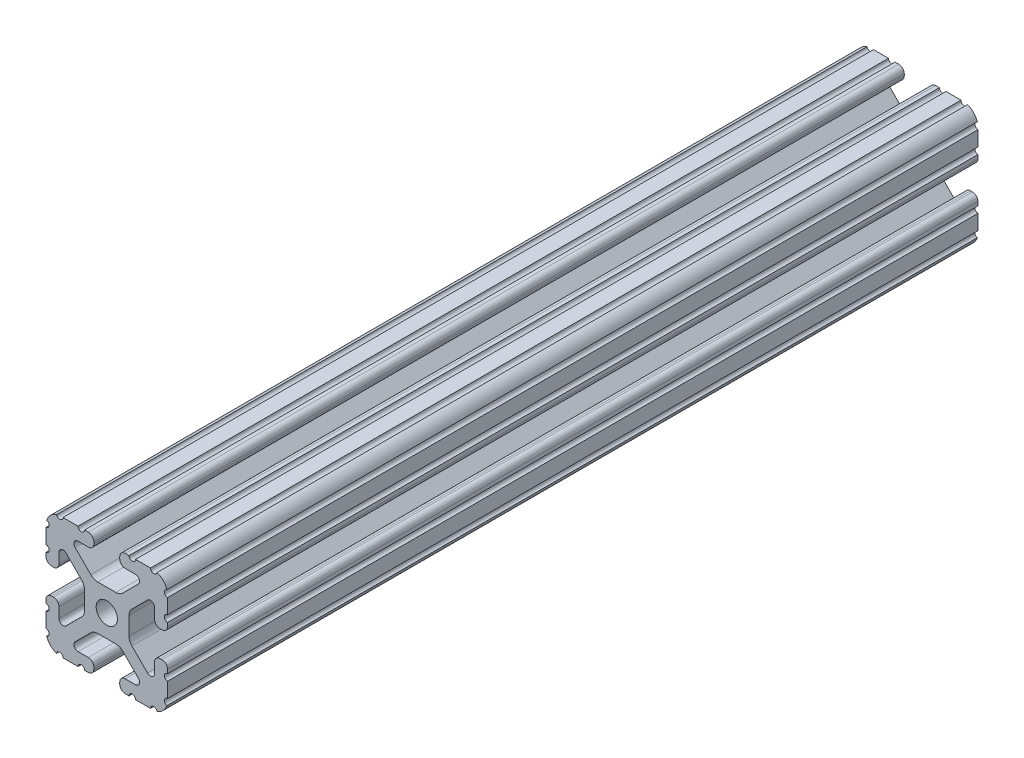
SolidWorks part; units mm, degrees
ref_plane "Front Plane" through (0, 0, 0) normal (0, 0, 1) x (1, 0, 0)
ref_plane "Top Plane" through (0, 0, 0) normal (0, 1, 0) x (1, 0, 0)
ref_plane "Right Plane" through (0, 0, 0) normal (1, 0, 0) x (0, 0, -1)
sketch "Sketch2" plane through (0, 0, 0) normal (0, 0, 1) x (1, 0, 0)
  line L0 (0, 19.05) -> (0, -19.05) construction
  line L1 (-19.05, 0) -> (19.05, 0) construction
  line L2 (4.064, -19.05) -> (19.05, -19.05)
  line L3 (19.05, -19.05) -> (19.05, -4.064)
  line L4 (4.064, -19.05) -> (4.064, -14.986)
  line L5 (4.064, -14.986) -> (12.1123, -14.986)
  line L6 (12.1123, -14.986) -> (4.1113, -6.985)
  line L7 (0, 0) -> (19.05, -19.05) construction
  line L8 (19.05, -4.064) -> (14.986, -4.064)
  line L9 (14.986, -4.064) -> (14.986, -12.1123)
  line L10 (14.986, -12.1123) -> (6.985, -4.1113)
  circle A0 centre (0, 0) radius 3.3274
  arc A1 (8.9963, -14.986) -> (9.909, -12.7826) centre (8.9963, -13.6953) ccw construction
  point P8 (0, -6.985)
sketch "Sketch3" plane through (0, 0, 0) normal (1, 0, 0) x (0, 0, -1)
  line L0 (-457.2, -19.05) -> (457.2, -19.05) construction
  line L1 (-431.8, 0) -> (431.8, 0) construction
sketch "Sketch4" plane through (0, 0, 0) normal (0, 0, 1) x (1, 0, 0)
  line L0 (5.7912, -19.05) -> (14.3002, -19.05)
  line L1 (4.064, -19.05) -> (19.05, -19.05) construction
  line L2 (4.064, -19.05) -> (4.064, -14.986) construction
  line L3 (4.064, -14.986) -> (12.1123, -14.986) construction
  line L4 (4.064, -16.7132) -> (4.064, -17.3228)
  line L5 (5.7912, -14.986) -> (8.9963, -14.986)
  line L6 (0, -6.985) -> (2.833, -6.985)
  line L7 (12.1123, -14.986) -> (4.1113, -6.985) construction
  line L8 (5.0152, -7.8889) -> (9.909, -12.7826)
  line L9 (19.05, -19.05) -> (19.05, -4.064) construction
  line L10 (14.986, -12.1123) -> (6.985, -4.1113) construction
  line L11 (14.986, -4.064) -> (14.986, -12.1123) construction
  line L12 (14.986, -8.9963) -> (14.986, -5.7912)
  line L13 (19.05, -4.064) -> (14.986, -4.064) construction
  line L14 (16.7132, -4.064) -> (17.3228, -4.064)
  line L15 (19.05, -5.7912) -> (19.05, -14.3002)
  line L16 (12.7826, -9.909) -> (7.8889, -5.0152)
  line L17 (6.985, 0) -> (6.985, -2.833)
  line L18 (-19.05, 0) -> (19.05, 0) construction
  line L19 (0, -6.985) -> (0, -3.3274)
  line L20 (0, 19.05) -> (0, -19.05) construction
  line L21 (6.985, 0) -> (3.3274, 0)
  arc A0 (4.064, -17.3228) -> (5.7912, -19.05) centre (5.7912, -17.3228) ccw
  arc A2 (4.064, -16.7132) -> (5.7912, -14.986) centre (5.7912, -16.7132) cw
  arc A3 (8.9963, -14.986) -> (9.909, -12.7826) centre (8.9963, -13.6953) ccw
  arc A4 (2.833, -6.985) -> (5.0152, -7.8889) centre (2.833, -10.0711) cw
  arc A5 (14.3002, -19.05) -> (19.05, -14.3002) centre (14.3002, -14.3002) ccw
  arc A6 (12.7826, -9.909) -> (14.986, -8.9963) centre (13.6953, -8.9963) ccw
  arc A7 (14.986, -5.7912) -> (16.7132, -4.064) centre (16.7132, -5.7912) cw
  arc A8 (17.3228, -4.064) -> (19.05, -5.7912) centre (17.3228, -5.7912) cw
  arc A9 (7.8889, -5.0152) -> (6.985, -2.833) centre (10.0711, -2.833) cw
  circle A10 centre (0, 0) radius 3.3274 construction
  arc A11 (0, -3.3274) -> (3.3274, 0) centre (0, 0) ccw
extrude "Boss-Extrude1" add sketch "Sketch4" along normal mid plane 914.4
sketch "Sketch5" plane through (0, 0, 0) normal (0, 0, 1) x (1, 0, 0)
  line L0 (4.064, -19.05) -> (19.05, -19.05) construction
  line L1 (5.7912, -14.986) -> (8.9963, -14.986) construction
  line L3 (0, 0) -> (19.05, -19.05) construction
  line L4 (8.9963, -14.986) -> (8.9963, -19.05) construction
  line L5 (12.1123, -14.986) -> (4.1113, -6.985) construction
  circle A0 centre (14.7395, -19.05) radius 1.016
  circle A1 centre (7.9803, -19.05) radius 1.016
  circle A2 centre (19.05, -14.7395) radius 1.016
  circle A3 centre (19.05, -7.9803) radius 1.016
  point P10 (7.3938, -14.986)
  point P12 (13.6953, -8.9963)
extrude "Cut-Extrude1" cut sketch "Sketch5" against normal through all both and the other way through all
mirror "Mirror1" about plane through (0, 0, 0) normal (1, 0, 0)
mirror "Mirror2" about plane through (0, 0, 0) normal (0, 1, 0)
sketch "Sketch6" plane through (0, 0, 457.2) normal (0, 0, 1) x (1, 0, 0)
  line L1 (19.5673, -19.4887) -> (-19.5673, -19.4887)
  line L2 (19.5673, -19.4887) -> (19.5673, 19.4887)
  line L3 (19.5673, 19.4887) -> (-19.5673, 19.4887)
  line L4 (-19.5673, -19.4887) -> (-19.5673, 19.4887)
  line L5 (19.5673, -19.4887) -> (-19.5673, 19.4887) construction
  line L6 (19.5673, 19.4887) -> (-19.5673, -19.4887) construction
  point P0 (0, 0)
extrude "Cut-Extrude2" cut sketch "Sketch6" against normal offset from surface (660.4 mm away) 254
equation "\"D1@Boss-Extrude1\"=\"Length@Sketch3\""
equation "\"D1@Sketch2\"=\"Thickness@Sketch2\""
equation "\"D2@Sketch4\"=\"Slot Inner Width@Sketch2\"*0.15"
equation "\"D1@Sketch4\"=\"D3@Sketch4\"*2.75"
equation "\"D3@Sketch4\"=\"Thickness@Sketch2\"*0.425"
equation "\"D1@Sketch5\"=\"Thickness@Sketch2\"*0.5"
